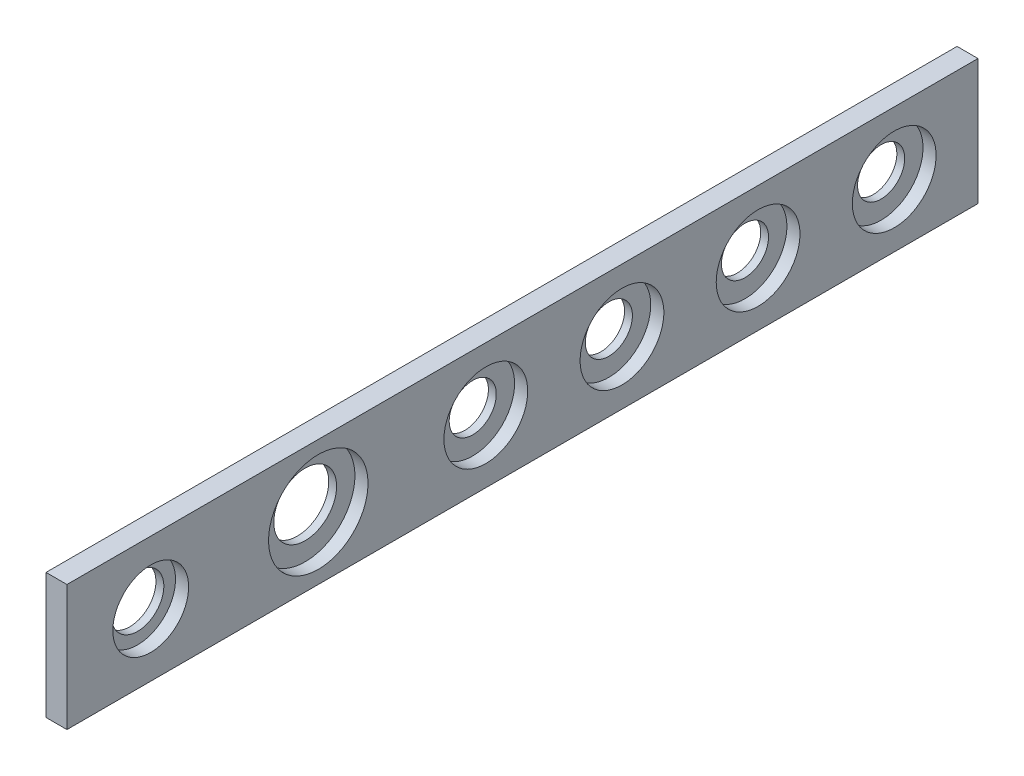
SolidWorks part; units mm, degrees
ref_plane "Front" through (0, 0, 0) normal (0, 0, 1) x (1, 0, 0)
ref_plane "Top" through (0, 0, 0) normal (0, 1, 0) x (1, 0, 0)
ref_plane "Right" through (0, 0, 0) normal (1, 0, 0) x (0, 0, -1)
mirrored part "Connector Bracket - Short Rev 2_Mirrored"
other "<Connector Bracket - Short Rev 2>-<Cut-Extrude2>"
